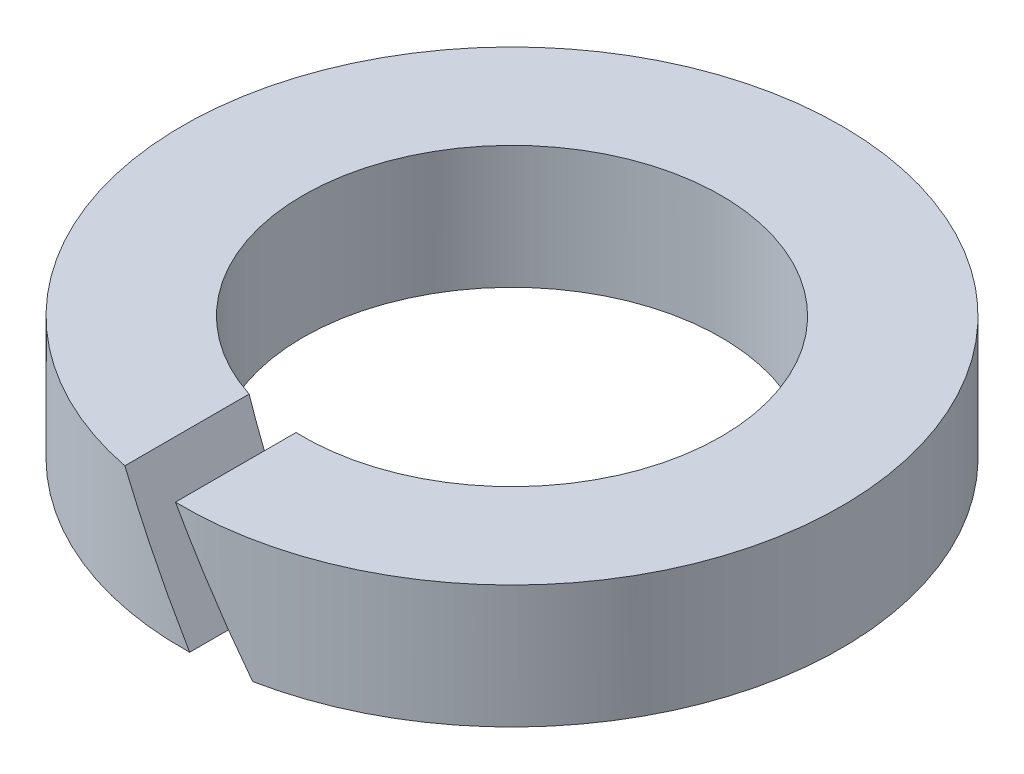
SolidWorks part; units mm, degrees
ref_plane "Base 1" through (0, 0, 0) normal (0, 0, 1) x (1, 0, 0)
ref_plane "Face" through (0, 0, 0) normal (0, 1, 0) x (1, 0, 0)
ref_plane "Base 2" through (0, 0, 0) normal (1, 0, 0) x (0, 0, -1)
sketch "section" plane through (0, 0, 0) normal (0, 0, 1) x (1, 0, 0)
  line L0 (4.25, 1.25) -> (6.7, 1.25)
  line L1 (4.25, 1.25) -> (4.25, -1.25)
  line L2 (6.7, -1.25) -> (4.25, -1.25)
  line L3 (6.7, -1.25) -> (6.7, 1.25)
  line L4 (0, 80) -> (0, -70) construction
  line L5 (6.7, 0) -> (4.25, 0) construction
  line L6 (50, 0) -> (-50, 0) construction
  dimension "A" = 4.25
  dimension "B" = 6.7
  dimension "C" = 2.5
revolve "Révolution" add sketch "section" angle 360 about L4
sketch "Sketch2" plane through (0, 0.6, 0) normal (0, 0, -1) x (-1, 0, 0)
  line L0 (1.4577, 1.9249) -> (-1.4577, -3.1249) construction
  line L1 (0, 49.4) -> (0, -50.6) construction
  line L2 (-1.299, -1.85) -> (0.1443, 0.65)
  line L3 (-0.1443, -1.85) -> (1.299, 0.65)
  line L4 (1.299, 0.65) -> (0.1443, 0.65)
  line L5 (-0.1443, -1.85) -> (-1.299, -1.85)
  line L6 (-6.7, -1.85) -> (6.7, -1.85) construction
  line L7 (-6.7, 0.65) -> (6.7, 0.65) construction
  dimension "D1" = 30
  dimension "K1" = 1
extrude "fente" cut sketch "Sketch2" against normal up to next
